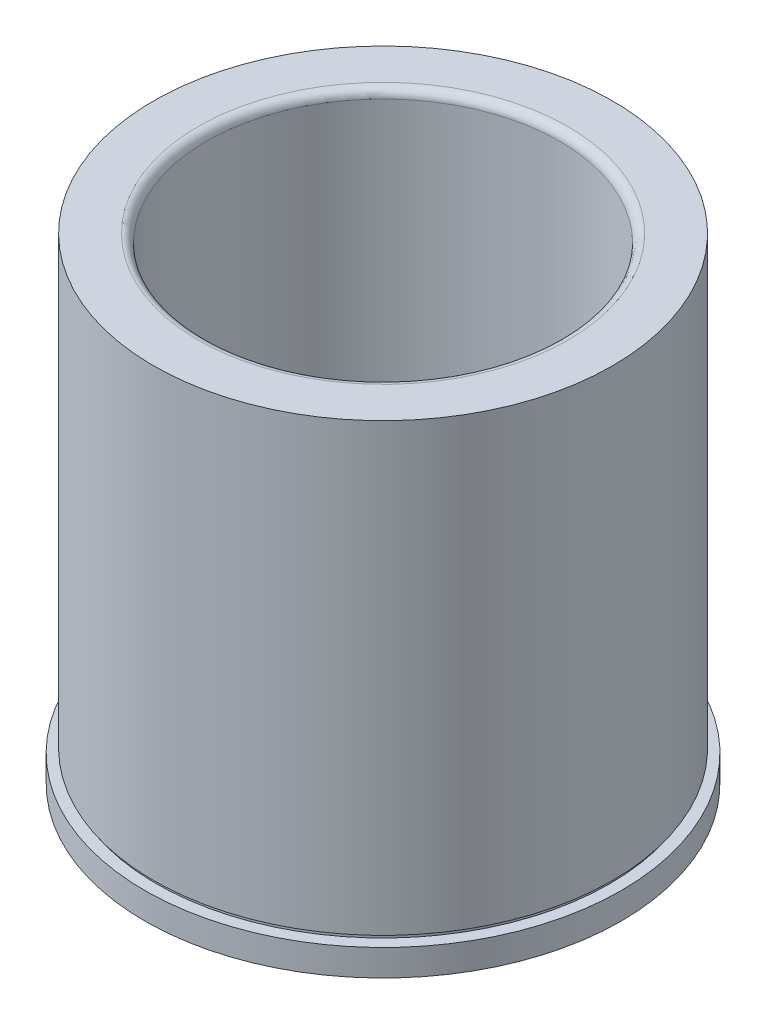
SolidWorks part; units mm, degrees
ref_plane "Front Plane" through (0, 0, 0) normal (0, 0, 1) x (1, 0, 0)
ref_plane "Top Plane" through (0, 0, 0) normal (0, 1, 0) x (1, 0, 0)
ref_plane "Right Plane" through (0, 0, 0) normal (1, 0, 0) x (0, 0, -1)
sketch "Sketch1" plane through (0, 0, 0) normal (0, 0, 1) x (1, 0, 0)
  line L0 (-954.952, 354.8153) -> (45914.4077, -17059.6364) construction
  line L1 (0, -1000) -> (0, 49000) construction
  line L2 (-31.7564, 101.6507) -> (-31.7563, 16.7417)
  line L3 (-32.5724, 15.9257) -> (-42.8625, 15.9257)
  line L4 (-42.8625, 15.9257) -> (-42.8625, 20.6882)
  line L5 (-42.8625, 20.6882) -> (-40.7733, 20.6882)
  line L6 (-41.2814, 101.6507) -> (-41.2813, 21.4502)
  line L7 (-41.2814, 101.6507) -> (-31.7564, 101.6507)
  line L8 (-32.5724, 15.9257) -> (-31.7563, 16.7417)
  line L10 (-41.2813, 21.4502) -> (-40.7733, 21.4502)
  line L11 (-40.7733, 21.4502) -> (-40.7733, 20.6882)
  dimension "D1" = 0.508
  dimension "OD" = 82.5627
  dimension "ID" = 63.5127
  dimension "FLANGETHICKNESS" = 4.7625
  dimension "FLANGEDIA" = 85.725
  dimension "D2" = 45
  dimension "D3" = 0.762
  dimension "OVERALL LENGTH" = 85.725
revolve "Revolve1" add sketch "Sketch1" angle 360 about L1
fillet "Fillet1" radius 1.524 1 edges at (31.7563, 101.6507, 0)
